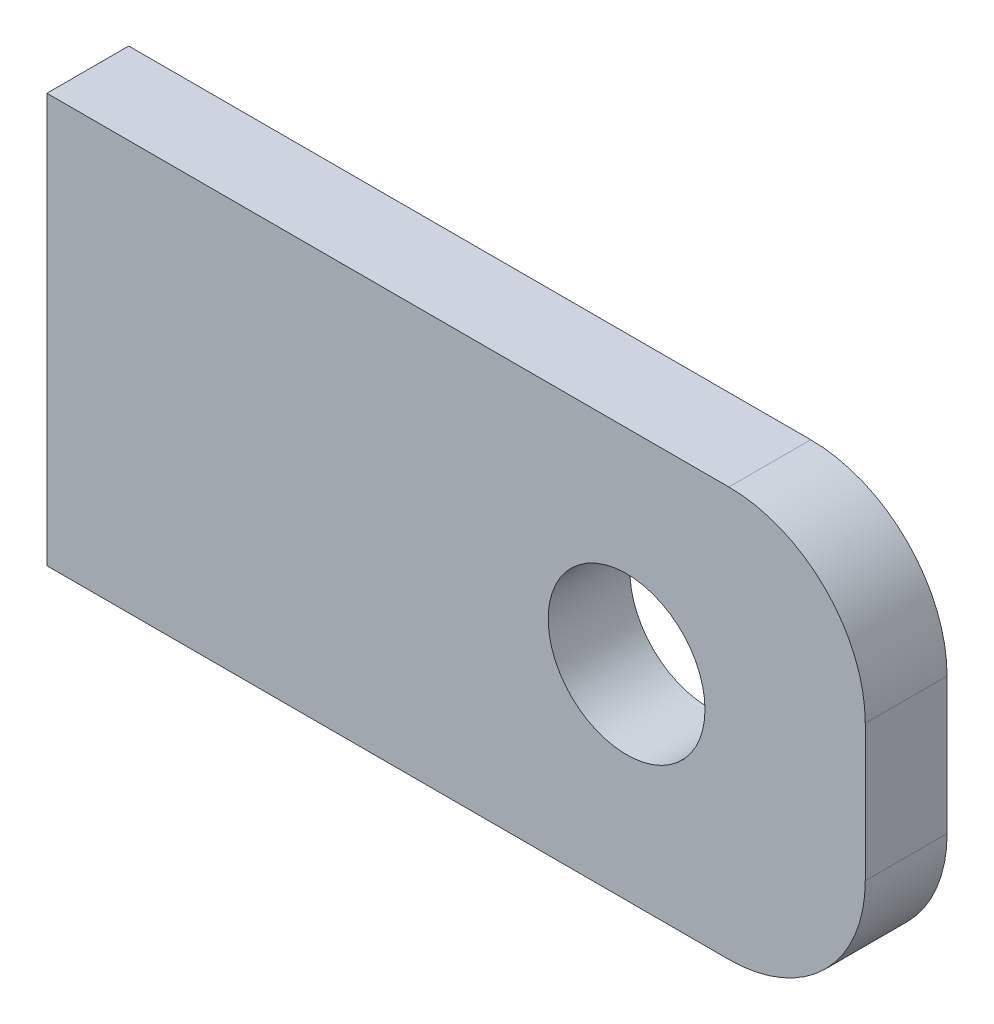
SolidWorks part; units mm, degrees
ref_plane "Face" through (0, 0, 0) normal (0, 0, 1) x (1, 0, 0)
ref_plane "Dessus" through (0, 0, 0) normal (0, 1, 0) x (1, 0, 0)
ref_plane "Droite" through (0, 0, 0) normal (1, 0, 0) x (0, 0, -1)
sketch "Esquisse1" plane through (0, 0, 0) normal (0, 0, 1) x (1, 0, 0)
  line L1 (0, 0) -> (100, 0)
  line L2 (0, 0) -> (0, -60)
  line L3 (0, -60) -> (100, -60)
  line L4 (120, -20) -> (120, -40)
  arc A0 (120, -20) -> (100, 0) centre (100, -20) ccw
  arc A1 (100, -60) -> (120, -40) centre (100, -40) ccw
  circle A2 centre (85, -30) radius 11.5
  point P7 (120, 0)
  dimension "D3" = 20
  dimension "D4" = 23
  dimension "D1" = 120
  dimension "D2" = 60
  dimension "D5" = 85
  dimension "D6" = 30
extrude "Base-Extrusion" add sketch "Esquisse1" along normal blind 12
